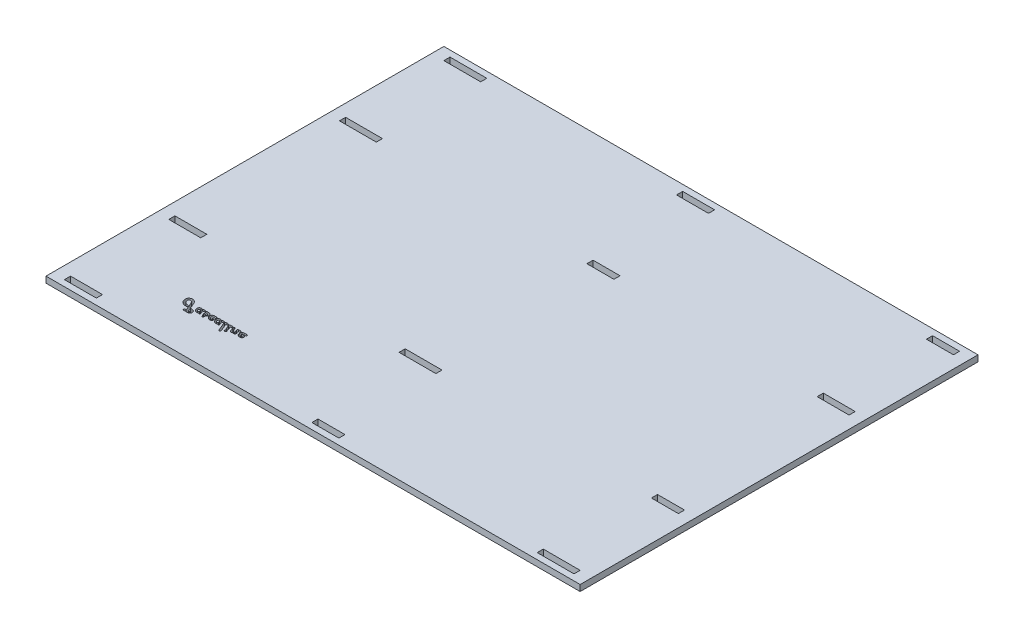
SolidWorks part; units mm, degrees
ref_plane "Front Plane" through (0, 0, 0) normal (0, 0, 1) x (1, 0, 0)
ref_plane "Top Plane" through (0, 0, 0) normal (0, 1, 0) x (1, 0, 0)
ref_plane "Right Plane" through (0, 0, 0) normal (1, 0, 0) x (0, 0, -1)
sketch "Sketch1" plane through (0, 0, 0) normal (0, 1, 0) x (1, 0, 0)
  line L1 (0, 0) -> (276.225, 0)
  line L2 (0, 0) -> (0, -205.74)
  line L3 (0, -205.74) -> (276.225, -205.74)
  line L4 (276.225, 0) -> (276.225, -205.74)
  line L5 (138.1125, -205.74) -> (138.1125, 0) construction
  line L6 (6.35, -57.15) -> (25.4, -57.15)
  line L7 (6.35, -6.35) -> (25.4, -6.35)
  line L8 (6.35, -6.35) -> (6.35, -3.175)
  line L9 (6.35, -3.175) -> (25.4, -3.175)
  line L10 (25.4, -6.35) -> (25.4, -3.175)
  line L11 (126.6825, -6.35) -> (143.1925, -6.35)
  line L12 (126.6825, -6.35) -> (126.6825, -3.175)
  line L13 (126.6825, -3.175) -> (143.1925, -3.175)
  line L14 (143.1925, -6.35) -> (143.1925, -3.175)
  line L15 (255.905, -6.35) -> (269.875, -6.35)
  line L16 (255.905, -6.35) -> (255.905, -3.175)
  line L17 (255.905, -3.175) -> (269.875, -3.175)
  line L18 (269.875, -6.35) -> (269.875, -3.175)
  line L19 (6.35, -57.15) -> (6.35, -60.325)
  line L20 (6.35, -60.325) -> (25.4, -60.325)
  line L21 (25.4, -57.15) -> (25.4, -60.325)
  line L22 (134.3025, -57.15) -> (148.2725, -57.15)
  line L23 (134.3025, -57.15) -> (134.3025, -60.325)
  line L24 (134.3025, -60.325) -> (148.2725, -60.325)
  line L25 (148.2725, -57.15) -> (148.2725, -60.325)
  line L26 (253.365, -57.15) -> (269.875, -57.15)
  line L27 (253.365, -57.15) -> (253.365, -60.325)
  line L28 (253.365, -60.325) -> (269.875, -60.325)
  line L29 (269.875, -57.15) -> (269.875, -60.325)
  line L30 (6.35, -145.415) -> (22.86, -145.415)
  line L31 (6.35, -145.415) -> (6.35, -148.59)
  line L32 (6.35, -148.59) -> (22.86, -148.59)
  line L33 (22.86, -145.415) -> (22.86, -148.59)
  line L34 (125.4125, -145.415) -> (144.4625, -145.415)
  line L35 (125.4125, -145.415) -> (125.4125, -148.59)
  line L36 (125.4125, -148.59) -> (144.4625, -148.59)
  line L37 (144.4625, -145.415) -> (144.4625, -148.59)
  line L38 (255.905, -148.59) -> (269.875, -148.59)
  line L39 (255.905, -148.59) -> (255.905, -145.415)
  line L40 (255.905, -145.415) -> (269.875, -145.415)
  line L41 (269.875, -148.59) -> (269.875, -145.415)
  line L42 (6.35, -202.565) -> (22.86, -202.565)
  line L43 (6.35, -202.565) -> (6.35, -199.39)
  line L44 (6.35, -199.39) -> (22.86, -199.39)
  line L45 (22.86, -202.565) -> (22.86, -199.39)
  line L46 (134.3025, -199.39) -> (148.2725, -199.39)
  line L47 (134.3025, -199.39) -> (134.3025, -202.565)
  line L48 (134.3025, -202.565) -> (148.2725, -202.565)
  line L49 (148.2725, -199.39) -> (148.2725, -202.565)
  line L50 (250.825, -199.39) -> (269.875, -199.39)
  line L51 (250.825, -199.39) -> (250.825, -202.565)
  line L52 (250.825, -202.565) -> (269.875, -202.565)
  line L53 (269.875, -199.39) -> (269.875, -202.565)
  point P21 (134.9375, -6.35)
  point P31 (141.2875, -57.15)
  point P44 (134.9375, -148.59)
  point P58 (141.2875, -202.565)
  dimension "D1" = 205.74
  dimension "D2" = 276.225
  dimension "D3" = 6.35
  dimension "D4" = 19.05
  dimension "D5" = 3.175
  dimension "D6" = 3.175
  dimension "D7" = 6.35
  dimension "D8" = 13.97
  dimension "D9" = 16.51
  dimension "D10" = 3.175
  dimension "D11" = 50.8
  dimension "D12" = 19.05
  dimension "D13" = 13.97
  dimension "D14" = 16.51
  dimension "D15" = 3.175
  dimension "D16" = 16.51
  dimension "D17" = 19.05
  dimension "D18" = 13.97
  dimension "D19" = 3.175
  dimension "D20" = 85.09
  dimension "D21" = 16.51
  dimension "D22" = 19.05
  dimension "D23" = 50.8
  dimension "D24" = 3.175
  dimension "D25" = 13.97
  dimension "D26" = 3.175
extrude "Boss-Extrude1" add sketch "Sketch1" along normal blind 3.175
sketch "Sketch2" plane through (0, 0, 0) normal (0, -1, 0) x (1, 0, 0)
  text T0 "Pascaline" font "Harlow Solid Italic" height in points 18
extrude "Cut-Extrude1" cut sketch "Sketch2" against normal through all
